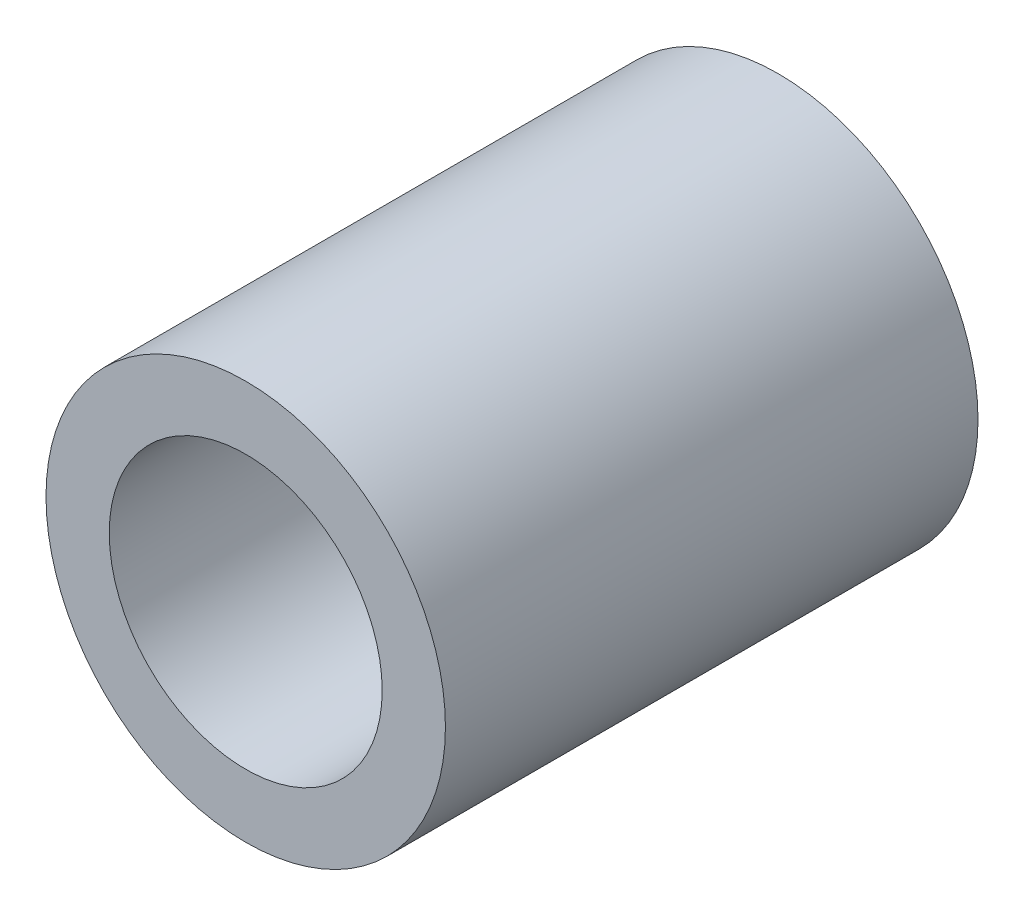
SolidWorks part; units mm, degrees
ref_plane "Face" through (0, 0, 0) normal (0, 0, 1) x (1, 0, 0)
ref_plane "Dessus" through (0, 0, 0) normal (0, 1, 0) x (1, 0, 0)
ref_plane "Droite" through (0, 0, 0) normal (1, 0, 0) x (0, 0, -1)
sketch "Esquisse1" plane through (0, 0, 0) normal (0, 0, 1) x (1, 0, 0)
  circle A0 centre (0, 0) radius 15
  circle A1 centre (0, 0) radius 10.25
  dimension "D1" = 20.5
  dimension "D2" = 30
extrude "Base-Extrusion" add sketch "Esquisse1" along normal blind 40
sketch "Esquisse2" plane through (0, 0, 0) normal (0, 1, 0) x (1, 0, 0)
  line L0 (15, 0) -> (-15, 0) construction
  circle A0 centre (0, -20) radius 3
  dimension "D1" = 6
  dimension "D2" = 20
extrude "Enlèv. mat.-Extru.1" cut sketch "Esquisse2" against normal blind 20
